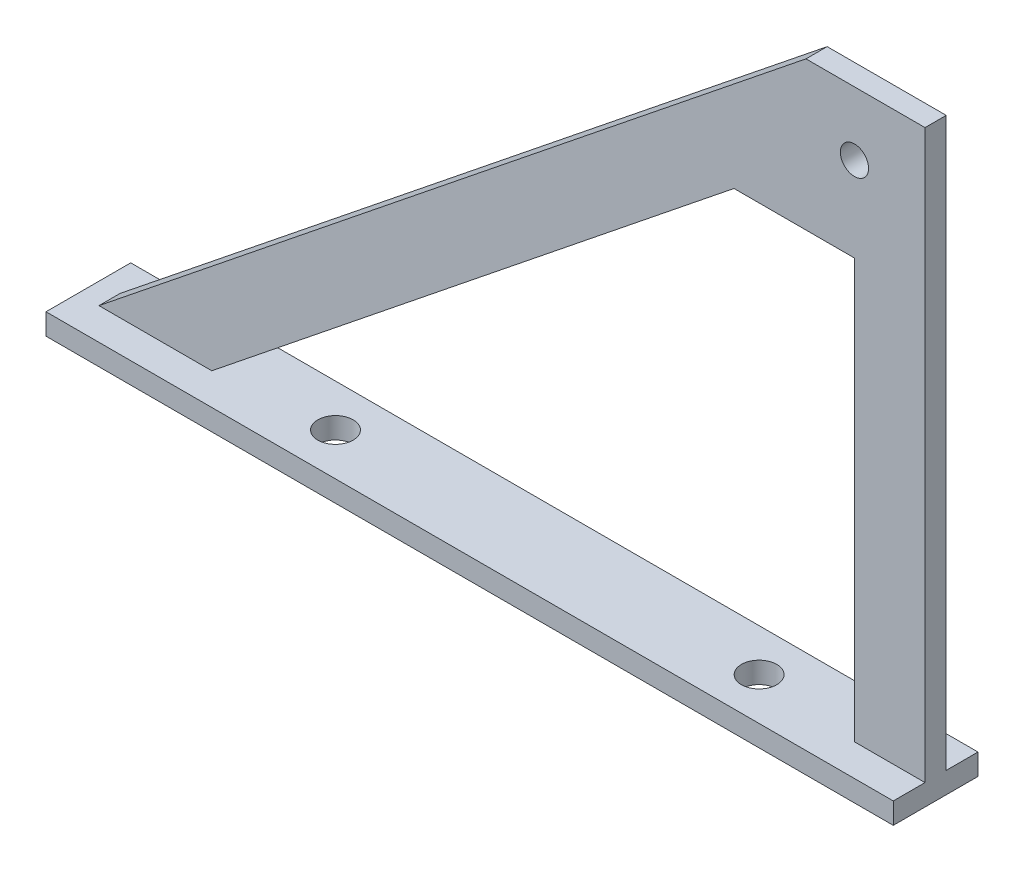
SolidWorks part; units mm, degrees
ref_plane "Front Plane" through (0, 0, 0) normal (0, 0, 1) x (1, 0, 0)
ref_plane "Top Plane" through (0, 0, 0) normal (0, 1, 0) x (1, 0, 0)
ref_plane "Right Plane" through (0, 0, 0) normal (1, 0, 0) x (0, 0, -1)
sketch "Sketch1" plane through (0, 0, 0) normal (0, 1, 0) x (1, 0, 0)
  line L0 (-60, -50) -> (-60, -62)
  line L1 (-60, 62) -> (60, 62)
  line L2 (-60, 62) -> (-60, 50)
  line L3 (-60, -62) -> (60, -62)
  line L4 (60, 62) -> (60, 50)
  line L6 (60, -50) -> (60, -62)
  line L7 (-60, 50) -> (60, 50)
  line L9 (-60, -50) -> (60, -50)
  point P0 (0, 0)
  point P6 (0, 0)
  dimension "D1" = 120
  dimension "D2" = 12
  dimension "D3" = 124
extrude "Boss-Extrude1" add sketch "Sketch1" along normal blind 3
sketch "Sketch2" plane through (0, 0, 62) normal (0, 0, 1) x (1, 0, 0)
  line L0 (-57, 3) -> (60, 96.8669)
  line L1 (-60, 3) -> (60, 3) construction
  line L2 (60, 96.8669) -> (60, 3)
  line L3 (60, 3) -> (50, 3)
  line L4 (50, 3) -> (50, 76.0236)
  line L5 (50, 76.0236) -> (-41.0199, 3)
  line L6 (-41.0199, 3) -> (-57, 3)
  dimension "D1" = 10
  dimension "D2" = 3
  dimension "D3" = 10
  dimension "D4" = 150
extrude "Boss-Extrude2" add sketch "Sketch2" along normal blind 3 from offset 7.5
sketch "Sketch3" plane through (0, 0, -50) normal (0, 0, 1) x (1, 0, 0)
  line L6 (60, 96.8669) -> (-57, 3)
  line L7 (60, 3) -> (60, 96.8669)
  line L8 (50, 3) -> (60, 3)
  line L9 (50, 76.0236) -> (50, 3)
  line L10 (-41.0199, 3) -> (50, 76.0236)
  line L11 (-57, 3) -> (-41.0199, 3)
  line L12 (60, 96.8669) -> (-57, 3)
  line L13 (60, 3) -> (60, 96.8669)
  line L14 (50, 3) -> (60, 3)
  line L15 (50, 76.0236) -> (50, 3)
  line L16 (-41.0199, 3) -> (50, 76.0236)
  line L17 (-57, 3) -> (-41.0199, 3)
  dimension "D1" = 0
extrude "Boss-Extrude3" add sketch "Sketch3" along normal blind 3 from offset 7.5
sketch "Sketch4" plane through (0, 3, 0) normal (0, 1, 0) x (1, 0, 0)
  line L0 (-60, -50) -> (-60, -62) construction
  line L1 (60, -62) -> (60, -57.5) construction
  line L2 (60, 50) -> (60, 54.5) construction
  line L3 (-60, 62) -> (-60, 50) construction
  line L4 (-60, 50) -> (60, 50) construction
  circle A0 centre (-25, 56) radius 2.5
  circle A1 centre (35, 56) radius 2.5
  circle A2 centre (-25, -56) radius 2.5
  circle A3 centre (35, -56) radius 2.5
  dimension "D1" = 5
  dimension "D2" = 5
  dimension "D5" = 5
  dimension "D6" = 5
  dimension "D3" = 35
  dimension "D4" = 25
  dimension "D7" = 25
  dimension "D8" = 35
extrude "Cut-Extrude1" cut sketch "Sketch4" against normal blind 7
sketch "Sketch5" plane through (0, 0, 57.5) normal (0, 0, 1) x (1, 0, 0)
  line L0 (32.9429, 62.339) -> (50, 62.339)
  line L1 (-41.0199, 3) -> (50, 76.0236) construction
  line L2 (50, 76.0236) -> (50, 3) construction
  line L3 (50, 83.6703) -> (32.9429, 69.9858)
  line L4 (32.9429, 69.9858) -> (32.9429, 62.339)
  line L5 (50, 83.6703) -> (55.4894, 76.828)
  line L6 (55.4894, 76.828) -> (55.4894, 62.339)
  line L7 (55.4894, 62.339) -> (50, 62.339)
extrude "Boss-Extrude4" add sketch "Sketch5" against normal blind 3
sketch "Sketch6" plane through (0, 0, -54.5) normal (0, 0, 1) x (1, 0, 0)
  line L6 (32.9429, 62.339) -> (50, 62.339)
  line L7 (50, 62.339) -> (55.4894, 62.339)
  line L8 (55.4894, 62.339) -> (55.4894, 76.828)
  line L9 (55.4894, 76.828) -> (50, 83.6703)
  line L10 (50, 83.6703) -> (32.9429, 69.9858)
  line L11 (32.9429, 69.9858) -> (32.9429, 62.339)
  line L12 (32.9429, 62.339) -> (50, 62.339)
  line L13 (50, 62.339) -> (55.4894, 62.339)
  line L14 (55.4894, 62.339) -> (55.4894, 76.828)
  line L15 (55.4894, 76.828) -> (50, 83.6703)
  line L16 (50, 83.6703) -> (32.9429, 69.9858)
  line L17 (32.9429, 69.9858) -> (32.9429, 62.339)
  dimension "D1" = 0
extrude "Boss-Extrude5" add sketch "Sketch6" against normal blind 3
sketch "Sketch7" plane through (0, 0, 57.5) normal (0, 0, 1) x (1, 0, 0)
  line L0 (60, 3) -> (60, 96.8669) construction
  line L1 (32.9429, 62.339) -> (50, 62.339) construction
  circle A0 centre (50, 74.339) radius 2
  dimension "D1" = 4
  dimension "D2" = 10
  dimension "D3" = 12
extrude "Cut-Extrude2" cut sketch "Sketch7" against normal blind 120
sketch "Sketch8" plane through (0, 0, 57.5) normal (0, 0, 1) x (1, 0, 0)
  line L0 (60, 83.339) -> (43.1382, 83.339)
  line L1 (60, 3) -> (60, 96.8669) construction
  line L2 (60, 96.8669) -> (-57, 3) construction
  line L3 (43.1382, 83.339) -> (60, 96.8669)
  line L4 (60, 96.8669) -> (60, 83.339)
  line L5 (32.9429, 62.339) -> (50, 62.339) construction
  dimension "D1" = 21
extrude "Cut-Extrude3" cut sketch "Sketch8" against normal blind 120
sketch "Sketch9" plane through (0, 0, -50) normal (0, 0, 1) x (1, 0, 0)
  line L1 (-67.0342, 87.8569) -> (104.0061, 87.8569)
  line L2 (-67.0342, 87.8569) -> (-67.0342, -24.9901)
  line L3 (-67.0342, -24.9901) -> (104.0061, -24.9901)
  line L4 (104.0061, 87.8569) -> (104.0061, -24.9901)
  line L5 (-67.0342, 87.8569) -> (104.0061, -24.9901) construction
  line L6 (-67.0342, -24.9901) -> (104.0061, 87.8569) construction
  point P0 (18.4859, 31.4334)
extrude "Cut-Extrude4" cut sketch "Sketch9" against normal blind 20
